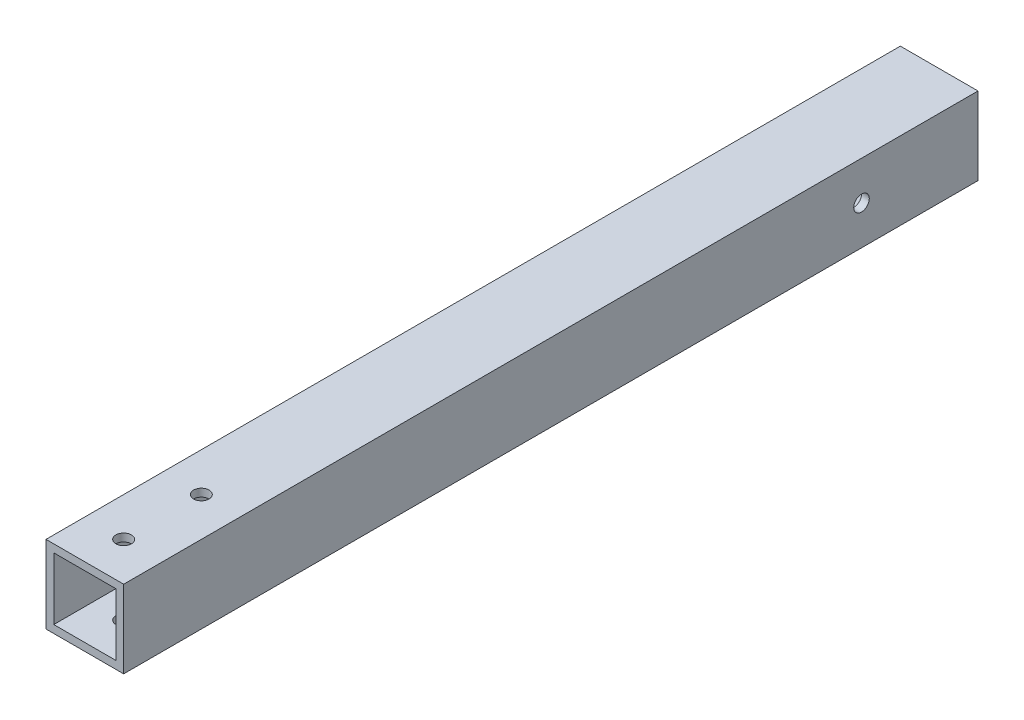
SolidWorks part; units mm, degrees
ref_plane "前视基准面" through (0, 0, 0) normal (0, 0, 1) x (1, 0, 0)
ref_plane "上视基准面" through (0, 0, 0) normal (0, 1, 0) x (1, 0, 0)
ref_plane "右视基准面" through (0, 0, 0) normal (1, 0, 0) x (0, 0, -1)
sketch "草图1" plane through (0, 0, 0) normal (0, 0, 1) x (1, 0, 0)
  line L0 (-8, 8) -> (8, 8)
  line L1 (-10, 10) -> (10, 10)
  line L2 (-10, 10) -> (-10, -10)
  line L3 (-10, -10) -> (10, -10)
  line L4 (10, 10) -> (10, -10)
  line L5 (-10, 10) -> (10, -10) construction
  line L6 (-10, -10) -> (10, 10) construction
  line L7 (8, 8) -> (8, -8)
  line L8 (-8, -8) -> (8, -8)
  line L9 (-8, 8) -> (-8, -8)
  point P0 (0, 0)
  dimension "D1" = 20
  dimension "D2" = 20
  dimension "D3" = 2
extrude "凸台-拉伸1" add sketch "草图1" along normal blind 220
hole_wizard "Ø4.0 (4) 直径孔1" positions "草图2" profile "草图3" hole size "Ø4.0" standard "GB"
sketch "草图2" plane through (0, 10, 0) normal (0, 1, 0) x (1, 0, 0)
  point P0 (0, -210)
  point P3 (0, -190)
  point P13 (0, 0)
  point P14 (0, 0)
sketch "草图3" plane through (0, 10, 210) normal (1, 0, 0) x (0, 0, 1)
  line L0 (0, 0) -> (0, 20)
  line L1 (0, 20) -> (2, 20)
  line L2 (2, 20) -> (2, 0)
  line L5 (2, 0) -> (0, 0)
  line L11 (0, -6.35) -> (0, 107.95) construction
  dimension "通孔孔直径" = 4
  dimension "通孔孔深度" = 20
hole_wizard "Ø4.0 (4) 直径孔2" positions "草图4" profile "草图5" hole size "Ø4.0" standard "GB"
sketch "草图4" plane through (-10, 0, 0) normal (-1, 0, 0) x (0, 0, 1)
  point P0 (30, 0)
sketch "草图5" plane through (-10, 0, 30) normal (0, 1, 0) x (0, 0, 1)
  line L0 (0, 0) -> (0, 20)
  line L1 (0, 20) -> (2, 20)
  line L2 (2, 20) -> (2, 0)
  line L5 (2, 0) -> (0, 0)
  line L11 (0, -6.35) -> (0, 107.95) construction
  dimension "通孔孔直径" = 4
  dimension "通孔孔深度" = 20
